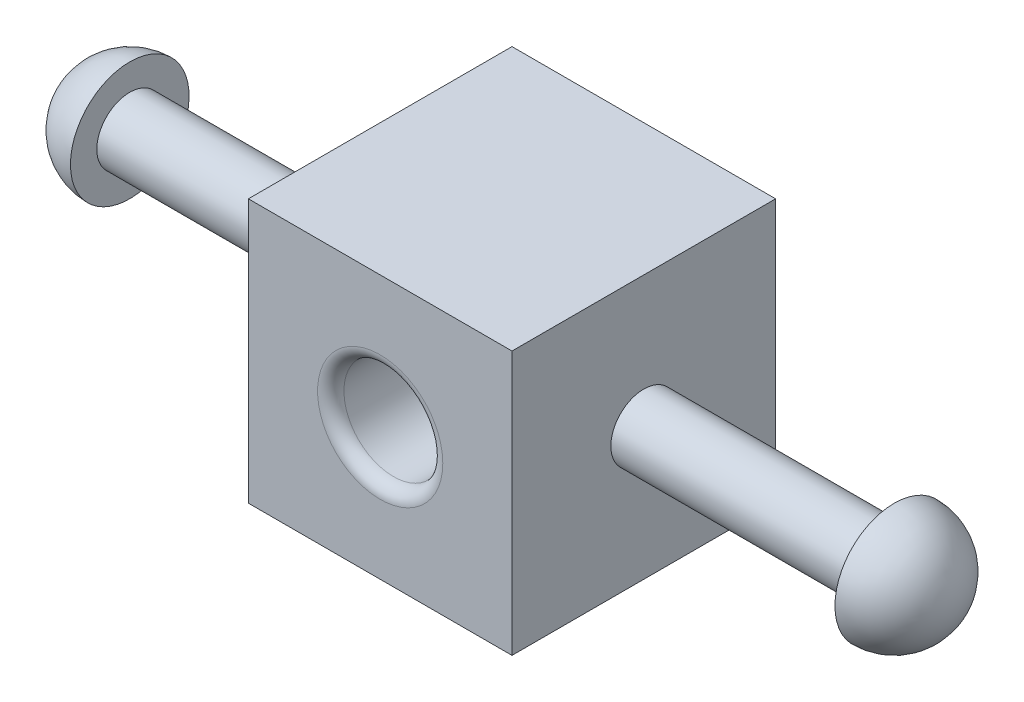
SolidWorks part; units mm, degrees
ref_plane "Front Plane" through (0, 0, 0) normal (0, 0, 1) x (1, 0, 0)
ref_plane "Top Plane" through (0, 0, 0) normal (0, 1, 0) x (1, 0, 0)
ref_plane "Right Plane" through (0, 0, 0) normal (1, 0, 0) x (0, 0, -1)
sketch "Sketch1" plane through (0, 0, 0) normal (0, 0, 1) x (1, 0, 0)
  line L0 (36.83, 15.875) -> (-36.83, 15.875)
  line L1 (-36.83, 15.875) -> (-36.83, 18.415)
  line L2 (-42.545, 12.7) -> (42.545, 12.7)
  line L3 (0, 12.7) -> (0, 64.2698) construction
  line L4 (36.83, 15.875) -> (36.83, 18.415)
  arc A0 (-36.83, 18.415) -> (-42.545, 12.7) centre (-36.83, 12.7) ccw
  arc A1 (36.83, 18.415) -> (42.545, 12.7) centre (36.83, 12.7) cw
  point P0 (0, 64.2698)
  dimension "D1" = 5.715
  dimension "D2" = 36.83
  dimension "D3" = 3.175
  dimension "D4" = 12.7
revolve "Revolve1" add sketch "Sketch1" angle 360 about L2
sketch "Sketch2" plane through (0, 0, 0) normal (0, 0, 1) x (1, 0, 0)
  line L1 (-12.7, 25.4) -> (12.7, 25.4)
  line L2 (-12.7, 25.4) -> (-12.7, 0)
  line L3 (-12.7, 0) -> (12.7, 0)
  line L4 (12.7, 25.4) -> (12.7, 0)
  point P4 (0, 0)
  point P6 (0, 0)
  dimension "D1" = 25.4
  dimension "D2" = 25.4
extrude "Boss-Extrude1" add sketch "Sketch2" along normal mid plane 25.4 separate body
sketch "Sketch3" plane through (0, 0, 12.7) normal (0, 0, 1) x (1, 0, 0)
  line L0 (12.7, 0) -> (12.7, 25.4) construction
  line L1 (12.7, 25.4) -> (-12.7, 25.4) construction
  circle A0 centre (0, 12.7) radius 4.7625
  point P4 (0, 0)
  point P5 (12.7, 12.7)
  point P8 (0, 25.4)
  dimension "D1" = 9.525
extrude "Cut-Extrude1" cut sketch "Sketch3" against normal through all
fillet "Fillet1" radius 1.27 1 edges at (4.7625, 12.7, 12.7)
fillet "Fillet2" radius 1.27 1 edges at (4.7625, 12.7, -12.7)
